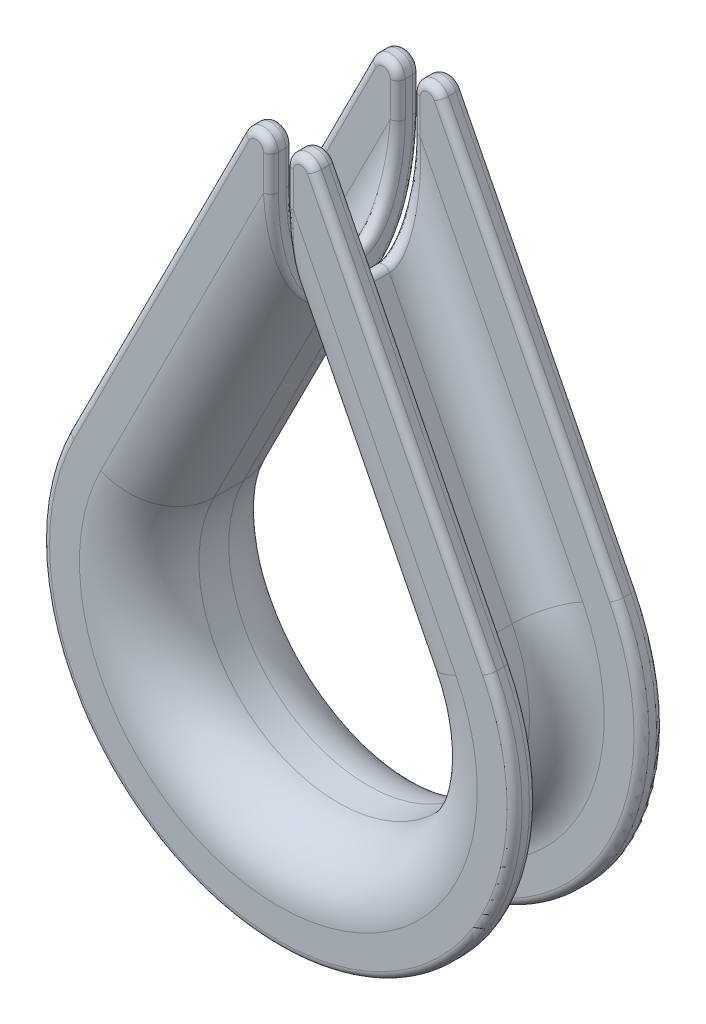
SolidWorks part; units mm, degrees
ref_plane "Plan de face" through (0, 0, 0) normal (0, 0, 1) x (1, 0, 0)
ref_plane "Plan de dessus" through (0, 0, 0) normal (0, 1, 0) x (1, 0, 0)
ref_plane "Plan de droite" through (0, 0, 0) normal (1, 0, 0) x (0, 0, -1)
ref_plane "Plan4" through (0, 0, 5) normal (0, 0, 1) x (1, 0, 0)
sketch "Esquisse1" plane through (0, 0, 5) normal (0, 0, 1) x (1, 0, 0)
  line L0 (-8.3227, 4.2058) -> (-0.5, 19.6856)
  line L1 (-0.5, 19.6856) -> (-0.5, 29.9011)
  line L2 (-2.3925, 30.3521) -> (-14.124, 7.1375)
  line L3 (14.124, 7.1375) -> (2.3925, 30.3521)
  line L4 (0.5, 29.9011) -> (0.5, 19.6856)
  line L5 (0.5, 19.6856) -> (8.3227, 4.2058)
  arc A0 (8.3227, 4.2058) -> (-8.3227, 4.2058) centre (0, 0) cw
  arc A1 (-0.5, 29.9011) -> (-2.3925, 30.3521) centre (-1.5, 29.9011) ccw
  arc A2 (-14.124, 7.1375) -> (14.124, 7.1375) centre (0, 0) ccw
  arc A3 (2.3925, 30.3521) -> (0.5, 29.9011) centre (1.5, 29.9011) ccw
extrude "Boss.-Extru.1" add sketch "Esquisse1" against normal blind 1.5
sketch "Esquisse2" plane through (0, 0, 3.5) normal (0, 0, -1) x (-1, 0, 0)
  line L0 (-9.6614, 4.8824) -> (-0.5, 23.0113)
  line L1 (-0.5, 23.0113) -> (-0.5, 19.6856)
  line L2 (-0.5, 19.6856) -> (-8.3227, 4.2058)
  line L3 (8.3227, 4.2058) -> (0.5, 19.6856)
  line L4 (0.5, 19.6856) -> (0.5, 23.0113)
  line L5 (0.5, 23.0113) -> (9.6614, 4.8824)
  arc A0 (-8.3227, 4.2058) -> (8.3227, 4.2058) centre (0, 0) ccw
  arc A1 (9.6614, 4.8824) -> (-9.6614, 4.8824) centre (0, 0) cw
extrude "Boss.-Extru.2" add sketch "Esquisse2" along normal blind 7
sketch "Esquisse3" plane through (0, 0, -3.5) normal (0, 0, -1) x (-1, 0, 0)
  line L0 (0.5, 19.6856) -> (0.5, 29.9011)
  line L1 (2.3925, 30.3521) -> (14.124, 7.1375)
  line L2 (-14.124, 7.1375) -> (-2.3925, 30.3521)
  line L3 (-0.5, 29.9011) -> (-0.5, 19.6856)
  line L4 (-0.5, 19.6856) -> (-8.3227, 4.2058)
  line L5 (8.3227, 4.2058) -> (0.5, 19.6856)
  arc A0 (0.5, 29.9011) -> (2.3925, 30.3521) centre (1.5, 29.9011) cw
  arc A1 (14.124, 7.1375) -> (-14.124, 7.1375) centre (0, 0) cw
  arc A2 (-2.3925, 30.3521) -> (-0.5, 29.9011) centre (-1.5, 29.9011) cw
  arc A3 (-8.3227, 4.2058) -> (8.3227, 4.2058) centre (0, 0) ccw
extrude "Boss.-Extru.3" add sketch "Esquisse3" along normal blind 1.5
fillet "Congé1" radius 2.5 3 edges at (0, -10.825, 3.5)
fillet "Congé2" radius 2.5 3 edges at (0, -10.825, -3.5)
fillet "Congé3" radius 4 3 edges at (-4.4113, 11.9457, -5) (0, -9.325, -5) (4.4113, 11.9457, -5)
fillet "Congé4" radius 4 3 edges at (4.4113, 11.9457, 5) (-4.4113, 11.9457, 5) (0, -9.325, 5)
fillet "Congé5" radius 0.5 20 edges at (1.2682, 30.8739, 3.5) (0.5, 24.6348, 2.7678) (8.2582, 18.7448, 3.5) (0, -15.825, 3.5) (0.5, 24.6348, -2.7678) (-8.2582, 18.7448, 3.5) (-1.2682, 30.8739, 3.5) (1.2682, 30.8739, -3.5) (8.2582, 18.7448, -3.5) (-0.5, 24.6348, 2.7678) (0, -15.825, -3.5) (-8.2582, 18.7448, -3.5) (-0.5, 24.6348, -2.7678) (-1.2682, 30.8739, -3.5)
fillet "Congé6" radius 0.5 20 edges at (8.2582, 18.7448, -5) (1.2682, 30.8739, -5) (0, -15.825, -5) (0.5, 29.2277, -5) (-8.2582, 18.7448, -5) (0.5, 22.2831, -3.8284) (-1.2682, 30.8739, -5) (0.5, 19.6856, 0) (-0.5, 29.2277, -5) (0.5, 22.2831, 3.8284) (-0.5, 22.2831, -3.8284) (0.5, 29.2277, 5) (-0.5, 19.6856, 0) (1.2682, 30.8739, 5) (-0.5, 22.2831, 3.8284) (8.2582, 18.7448, 5) (-0.5, 29.2277, 5) (0, -15.825, 5) (-1.2682, 30.8739, 5) (-8.2582, 18.7448, 5)
